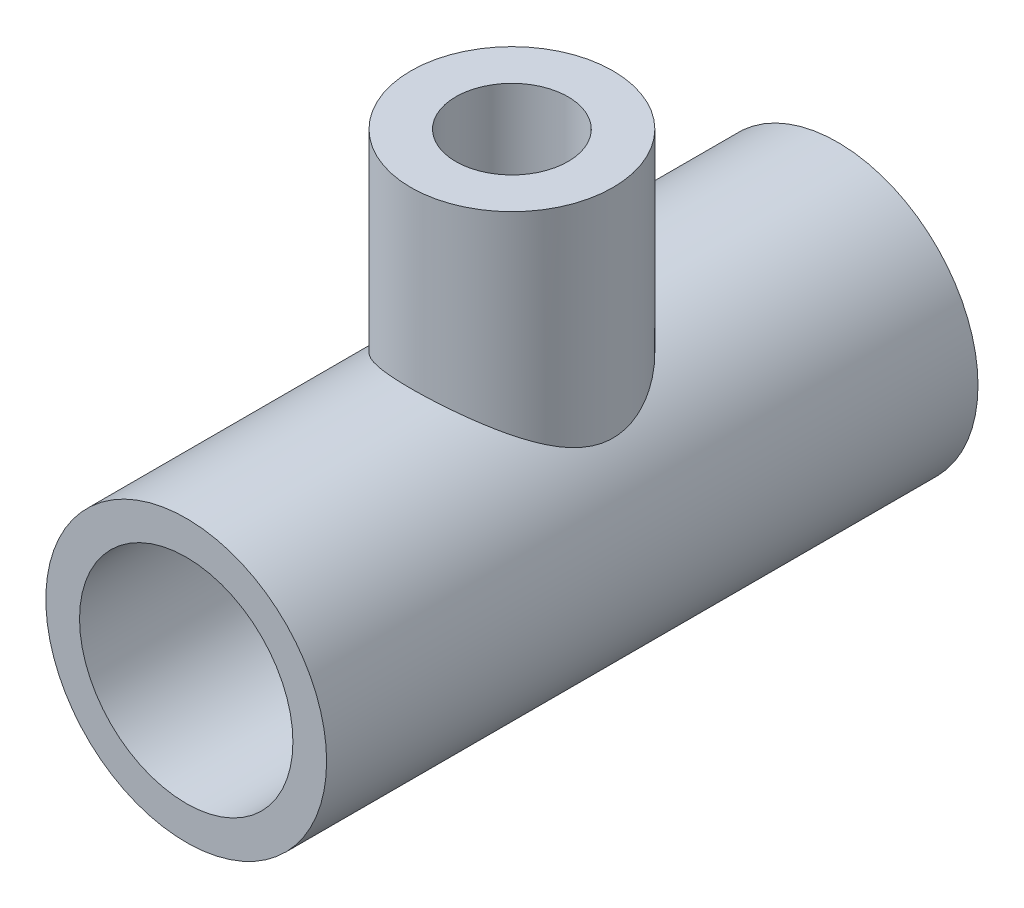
SolidWorks part; units mm, degrees
ref_plane "Plan de face" through (0, 0, 0) normal (0, 0, 1) x (1, 0, 0)
ref_plane "Plan de dessus" through (0, 0, 0) normal (0, 1, 0) x (1, 0, 0)
ref_plane "Plan de droite" through (0, 0, 0) normal (1, 0, 0) x (0, 0, -1)
sketch "Esquisse1" plane through (0, 0, 0) normal (0, 0, 1) x (1, 0, 0)
  circle A0 centre (0, 0) radius 6.25
  dimension "D1" = 12.5
extrude "Boss.-Extru.1" add sketch "Esquisse1" along normal blind 29
sketch "Esquisse2" plane through (0, 0, 0) normal (0, 0, -1) x (-1, 0, 0)
  circle A0 centre (0, 0) radius 4.75
  dimension "D1" = 9.5
sketch "Esquisse3" plane through (0, 0, 0) normal (0, 1, 0) x (1, 0, 0)
  line L0 (-6.25, -29) -> (6.25, 0) construction
  line L5 (12.5, -100) -> (-12.5, 0) construction
  circle A0 centre (0, -14.5) radius 4.5
  dimension "D1" = 9
extrude "Boss.-Extru.2" add sketch "Esquisse3" along normal blind 14
sketch "Esquisse4" plane through (0, 14, 0) normal (0, 1, 0) x (1, 0, 0)
  circle A0 centre (0, -14.5) radius 2.5
  dimension "D1" = 5
extrude "Enlèv. mat.-Extru.3" cut sketch "Esquisse4" against normal blind 6
extrude "Enlèv. mat.-Extru.4" cut sketch "Esquisse2" against normal blind 119.7859 contours A0
thread "Filetage2" pitch 0.3175 start angle 0, offset 0, length 3, pitch 0.3175, diameter 7
ref_plane "Plan8" through (-3.5, 9.7859, 14.5) normal (0, 0, 1) x (-1, 0, 0)
sketch "Profil de filetage8" [suppressed] plane through (-3.5, 9.7859, 14.5) normal (0, 0, 1) x (-1, 0, 0)
  line L0 (0, 0) -> (0, 0.3175) construction
  line L11 (0, 0) -> (0, 0.2778)
  line L12 (0, 0.2778) -> (-0.1719, 0.1786)
  line L13 (-0.1719, 0.1786) -> (-0.1719, 0.0992)
  line L15 (-0.1719, 0.0992) -> (0, 0)
  line L17 (-0.1719, 0.1389) -> (0, 0.1389) construction
  point P2 (0, 0)
  dimension "Pitch" = 0.3175
  dimension "Profile_Angle" = 60
  dimension "Profile_Land" = 0.0794
  dimension "Profile_Height" = 0.1719
